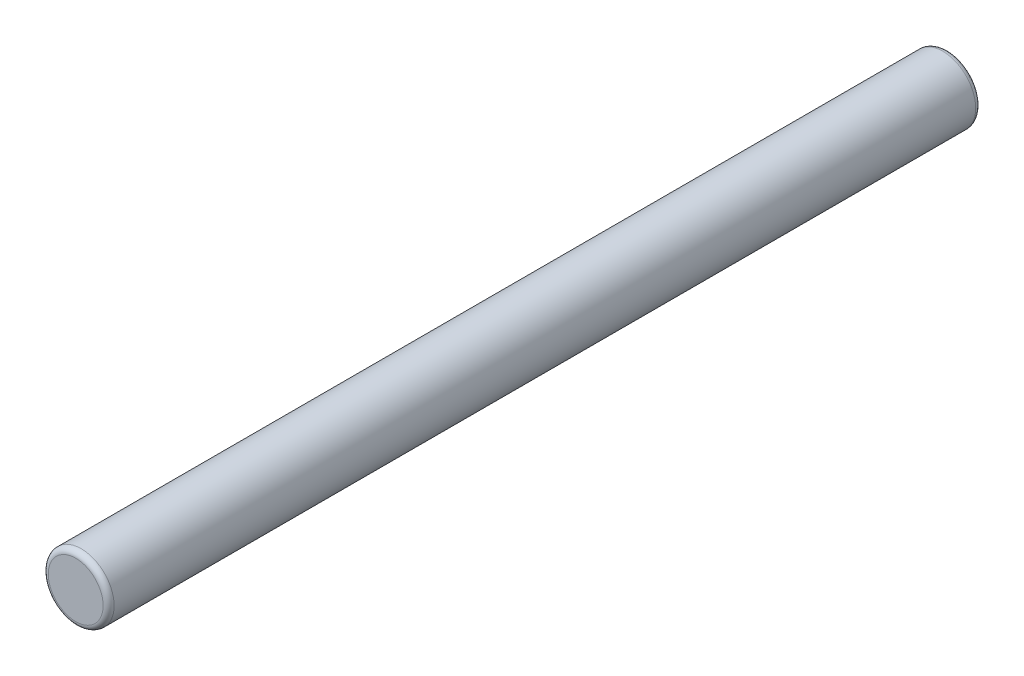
SolidWorks part; units mm, degrees
ref_plane "Piano frontale" through (0, 0, 0) normal (0, 0, 1) x (1, 0, 0)
ref_plane "Piano superiore" through (0, 0, 0) normal (0, 1, 0) x (1, 0, 0)
ref_plane "Piano destro" through (0, 0, 0) normal (1, 0, 0) x (0, 0, -1)
sketch "Schizzo1" plane through (0, 0, 0) normal (0, 0, 1) x (1, 0, 0)
  circle A0 centre (0, 0) radius 6
  dimension "D1" = 12
extrude "Estrusione-Estrusione1" add sketch "Schizzo1" along normal mid plane 159
fillet "Raccordo1" radius 1 2 edges at (6, 0, -79.5) (6, 0, 79.5)
sketch "Linee di piegatura1" [suppressed] plane through (0, 0, 0) normal (0, 1, 0) x (1, 0, 0)
sketch "Casella di contorno1" [suppressed] plane through (0, 0, 0) normal (0, 1, 0) x (1, 0, 0)
equation "\"Lam_vern\"= 2 * ( \"SW-Massa\" / \"SW-Densità\" ) / ( \"Spessore\" / 1000 )"
